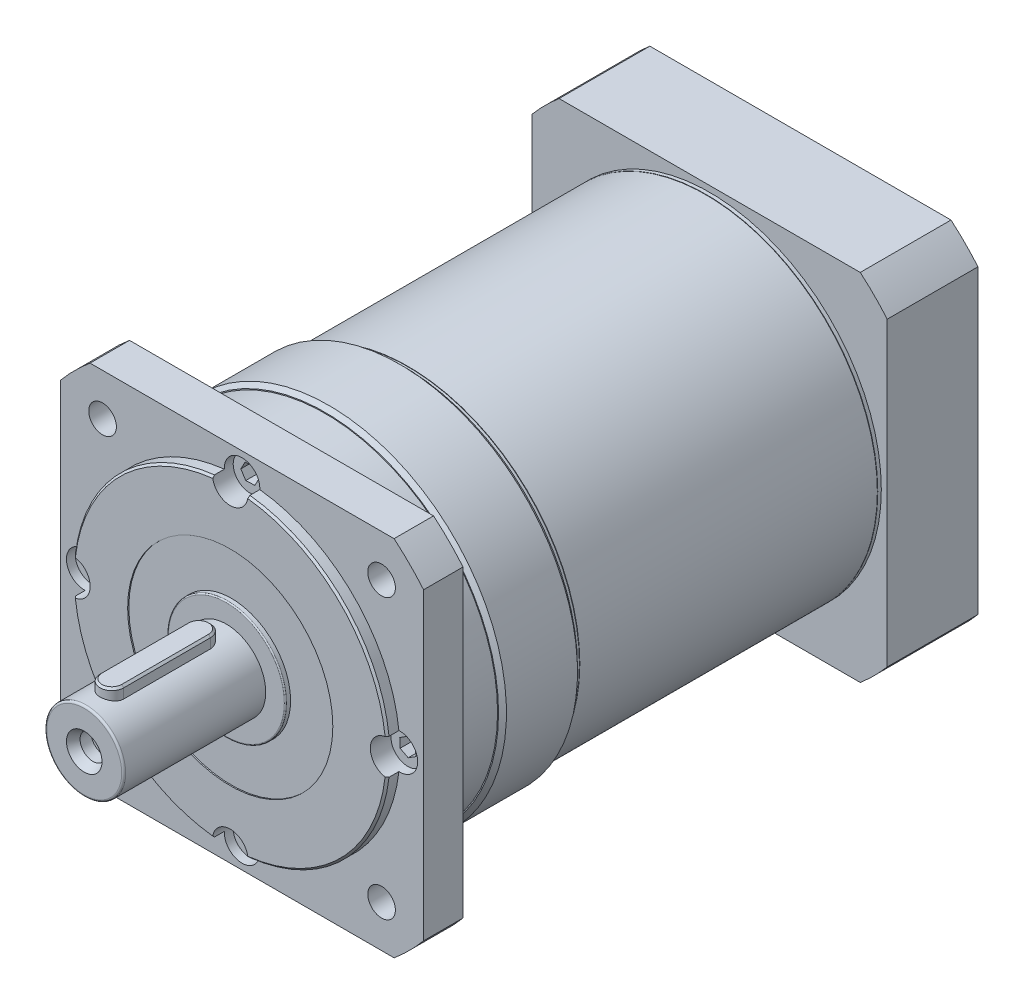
SolidWorks part; units mm, degrees
ref_plane "前视基准面" through (0, 0, 0) normal (0, 0, 1) x (1, 0, 0)
ref_plane "上视基准面" through (0, 0, 0) normal (0, 1, 0) x (1, 0, 0)
ref_plane "右视基准面" through (0, 0, 0) normal (1, 0, 0) x (0, 0, -1)
sketch "草图1" plane through (0, 0, 0) normal (0, 0, 1) x (1, 0, 0)
  circle A0 centre (0, 0) radius 45
extrude "凸台-拉伸1" add sketch "草图1" along normal blind 42
sketch "草图2" plane through (0, 0, 42) normal (0, 0, 1) x (1, 0, 0)
  circle A0 centre (0, 0) radius 40
extrude "凸台-拉伸2" add sketch "草图2" along normal blind 3
sketch "草图3" plane through (0, 0, 0) normal (0, 0, -1) x (-1, 0, 0)
  circle A0 centre (0, 0) radius 43.5
extrude "切除-拉伸1" cut sketch "草图3" against normal blind 1 flip side to cut
sketch "草图25" plane through (0, 0, 42) normal (0, 0, 1) x (1, 0, 0)
  line L1 (-46, 46) -> (46, 46)
  line L2 (-46, 46) -> (-46, -46)
  line L3 (-46, -46) -> (46, -46)
  line L4 (46, 46) -> (46, -46)
  dimension "D1" = 46
  dimension "D2" = 92
  dimension "D3" = 46
  dimension "D4" = 92
extrude "凸台-拉伸13" add sketch "草图25" against normal blind 10
sketch "草图26" plane through (0, 0, 42) normal (0, 0, 1) x (1, 0, 0)
  circle A0 centre (0, 0) radius 60
extrude "切除-拉伸8" cut sketch "草图26" against normal blind 10 flip side to cut
sketch "草图27" plane through (0, 0, 42) normal (0, 0, 1) x (1, 0, 0)
  line L0 (0, 0) -> (-42.4264, 42.4264) construction
  circle A0 centre (0, 0) radius 50 construction
  arc A1 (-38.5227, 46) -> (-46, 38.5227) centre (0, 0) ccw construction
  circle A2 centre (-35.3553, 35.3553) radius 3.5
extrude "切除-拉伸9" cut sketch "草图27" against normal blind 10
pattern_circular "阵列(圆周)6" count 4 over 360 about axis through (0, 0, 0) along (0, 0, 1) of "切除-拉伸9"
sketch "草图28" plane through (0, 0, 32) normal (0, 0, -1) x (-1, 0, 0)
  circle A0 centre (0, 0) radius 43.75
extrude "切除-拉伸10" cut sketch "草图28" along normal blind 11 flip side to cut
chamfer "倒角5" distance 1 angle 45 1 edges at (-45, 0, 21)
chamfer "倒角1" distance 1 angle 45 1 edges at (-45, 0, 1)
ref_plane "基准面1" through (0, 0, -0.1) normal (0, 0, -1) x (-1, 0, 0)
sketch "草图4" plane through (0, 0, -0.1) normal (0, 0, -1) x (-1, 0, 0)
  circle A0 centre (0, 0) radius 43.5
extrude "凸台-拉伸3" add sketch "草图4" along normal blind 75.4 separate body
ref_plane "基准面2" through (0, 0, -75.6) normal (0, 0, -1) x (-1, 0, 0)
sketch "草图5" plane through (0, 0, -75.6) normal (0, 0, -1) x (-1, 0, 0)
  circle A0 centre (0, 0) radius 43.5
extrude "凸台-拉伸4" add sketch "草图5" along normal blind 0.9 separate body
sketch "草图6" plane through (0, 0, -76.5) normal (0, 0, -1) x (-1, 0, 0)
  line L1 (-38.1576, 45) -> (38.1576, 45)
  line L2 (-45, 38.1576) -> (-45, -38.1576)
  line L3 (-38.1576, -45) -> (38.1576, -45)
  line L4 (45, 38.1576) -> (45, -38.1576)
  arc A0 (-38.1576, 45) -> (-45, 38.1576) centre (0, 0) ccw
  arc A1 (-45, -38.1576) -> (-38.1576, -45) centre (0, 0) ccw
  arc A2 (38.1576, -45) -> (45, -38.1576) centre (0, 0) ccw
  arc A3 (45, 38.1576) -> (38.1576, 45) centre (0, 0) ccw
  dimension "D1" = 45
  dimension "D3" = 45
extrude "凸台-拉伸5" add sketch "草图6" along normal blind 23
sketch "草图7" plane through (0, 0, -99.5) normal (0, 0, -1) x (-1, 0, 0)
  circle A0 centre (0, 0) radius 35
extrude "切除-拉伸2" cut sketch "草图7" against normal blind 6
sketch "草图8" plane through (0, 0, -93.5) normal (0, 0, -1) x (-1, 0, 0)
  circle A0 centre (0, 0) radius 32
extrude "切除-拉伸3" cut sketch "草图8" against normal blind 20
sketch "草图9" plane through (0, 0, -99.5) normal (0, 0, -1) x (-1, 0, 0)
  line L0 (0, 0) -> (0, 40) construction
  line L1 (0, 0) -> (-13.6808, 37.5877) construction
  circle A0 centre (0, 0) radius 40 construction
  circle A1 centre (-13.6808, 37.5877) radius 4.5
  dimension "D1" = 20
extrude "切除-拉伸4" cut sketch "草图9" against normal blind 14
pattern_circular "阵列(圆周)1" count 4 over 360 about axis through (0, 0, 0) along (0, 0, 1) of "切除-拉伸4"
sketch "草图10" plane through (0, 0, -99.5) normal (0, 0, -1) x (-1, 0, 0)
  line L0 (0, 0) -> (-31.8198, 31.8198)
  circle A0 centre (0, 0) radius 45
hole_wizard "M5 螺纹孔1" positions "3D草图1" profile "草图11" tap size "M5" standard "GB"
sketch3d "3D草图1"
  point P0 (31.8198, 31.8198, -99.5)
sketch "草图11" plane through (31.8198, 31.8198, -99.5) normal (1, 0, 0) x (0, 1, 0)
  line L0 (0, 0) -> (0, 17.2618)
  line L1 (0, 17.2618) -> (2.1, 16)
  line L2 (2.1, 16) -> (2.1, 0)
  line L5 (2.1, 0) -> (0, 0)
  line L10 (0, 17.2618) -> (-2.1, 16) construction
  line L11 (0, -6.35) -> (0, 107.95) construction
  dimension "螺纹孔钻头直径" = 4.2
  dimension "螺纹孔钻头深度" = 16
  dimension "导头角度" = 118
pattern_circular "阵列(圆周)2" count 4 over 360 about axis through (0, 0, 0) along (0, 0, 1) of "M5 螺纹孔1"
sketch "草图12" plane through (0, 0, -85.5) normal (0, 0, -1) x (-1, 0, 0)
  line L1 (-12.6133, 39.6356) -> (-14.9205, 39.5362)
  line L2 (-14.9205, 39.5362) -> (-15.9881, 37.4883)
  line L3 (-15.9881, 37.4883) -> (-14.7484, 35.5399)
  line L4 (-14.7484, 35.5399) -> (-12.4411, 35.6393)
  line L5 (-12.4411, 35.6393) -> (-11.3735, 37.6871)
  line L6 (-11.3735, 37.6871) -> (-12.6133, 39.6356)
  circle A0 centre (-13.6808, 37.5877) radius 4.25
  circle A1 centre (-13.6808, 37.5877) radius 2 construction
  dimension "D1" = 4
extrude "凸台-拉伸6" add sketch "草图12" along normal blind 5
pattern_circular "阵列(圆周)3" count 4 over 360 about axis through (0, 0, 0) along (0, 0, 1) of "凸台-拉伸6"
sketch "草图13" plane through (0, 0, 42) normal (0, 0, 1) x (1, 0, 0)
  line L0 (0, 0) -> (0, -40) construction
  circle A0 centre (0, 0) radius 40 construction
  circle A1 centre (0, -40) radius 4.5
extrude "切除-拉伸5" cut sketch "草图13" against normal blind 7
pattern_circular "阵列(圆周)4" count 4 over 360 about axis through (0, 0, 0) along (0, 0, 1) of "切除-拉伸5"
sketch "草图14" plane through (0, 0, 35) normal (0, 0, 1) x (1, 0, 0)
  line L1 (1.0702, -37.9535) -> (-1.2372, -38.05)
  line L2 (-1.2372, -38.05) -> (-2.3074, -40.0965)
  line L3 (-2.3074, -40.0965) -> (-1.0702, -42.0465)
  line L4 (-1.0702, -42.0465) -> (1.2372, -41.95)
  line L5 (1.2372, -41.95) -> (2.3074, -39.9035)
  line L6 (2.3074, -39.9035) -> (1.0702, -37.9535)
  circle A0 centre (0, -40) radius 4.25
  circle A1 centre (0, -40) radius 2 construction
  dimension "D1" = 4
extrude "凸台-拉伸7" add sketch "草图14" along normal blind 5
pattern_circular "阵列(圆周)5" count 4 over 360 about axis through (0, 0, 0) along (0, 0, 1) of "凸台-拉伸7"
sketch "草图15" plane through (0, 0, 42) normal (0, 0, 1) x (1, 0, 0)
  line L0 (0, 0) -> (-24.7487, 24.7487)
  circle A0 centre (0, 0) radius 35
ref_plane "基准面3" through (0, 0, -92.5) normal (0, 0, -1) x (-1, 0, 0)
sketch "草图17" plane through (0, 0, -92.5) normal (0, 0, -1) x (-1, 0, 0)
  circle A0 centre (0, 0) radius 26
extrude "凸台-拉伸8" add sketch "草图17" against normal up to surface (19 mm away)
chamfer "倒角2" distance 1.5 angle 45 1 edges at (-26, 0, -92.5)
sketch "草图18" plane through (0, 0, -92.5) normal (0, 0, -1) x (-1, 0, 0)
  line L1 (-30.5825, 0.5) -> (30.8028, 0.5)
  line L2 (-30.5825, 0.5) -> (-30.5825, -0.5)
  line L3 (-30.5825, -0.5) -> (30.8028, -0.5)
  line L4 (30.8028, 0.5) -> (30.8028, -0.5)
  dimension "D1" = 0.5
  dimension "D2" = 1
extrude "切除-拉伸6" cut sketch "草图18" against normal up to surface (19 mm away)
sketch "草图19" plane through (0, 0, -99.5) normal (0, 0, -1) x (-1, 0, 0)
  circle A0 centre (0, 0) radius 9.5
extrude "切除-拉伸7" cut sketch "草图19" against normal blind 42
chamfer "倒角3" distance 0.5 angle 45 1 edges at (40, 0, 45)
sketch "草图20" plane through (0, 0, 45) normal (0, 0, 1) x (1, 0, 0)
  circle A0 centre (0, 0) radius 15
extrude "凸台-拉伸9" add sketch "草图20" along normal blind 1
fillet "圆角2" radius 0.3 1 edges at (15, 0, 46)
sketch "草图22" plane through (0, 0, 46) normal (0, 0, 1) x (1, 0, 0)
  circle A0 centre (0, 0) radius 10
extrude "凸台-拉伸10" add sketch "草图22" along normal blind 36
fillet "圆角3" radius 0.5 1 edges at (10, 0, 82)
sketch "草图23" plane through (0, 0, 0) normal (0, 1, 0) x (1, 0, 0)
  line L0 (-9.5, -82) -> (9.5, -82) construction
  line L1 (-3, -53) -> (-3, -75)
  line L2 (3, -53) -> (3, -75)
  arc A0 (-3, -75) -> (3, -75) centre (0, -75) ccw
  arc A1 (3, -53) -> (-3, -53) centre (0, -53) ccw
  dimension "D1" = 7
  dimension "D2" = 22
extrude "凸台-拉伸11" add sketch "草图23" along normal blind 12.5
chamfer "倒角4" distance 0.5 angle 45 4 edges at (-3, 12.5, 64) (0, 12.5, 78) (0, 12.5, 50) (3, 12.5, 64)
sketch "草图30" plane through (0, 0, 45) normal (0, 0, 1) x (1, 0, 0)
  circle A0 centre (0, 40) radius 4.5
extrude "切除-拉伸11" cut sketch "草图30" against normal up to surface (3 mm away)
pattern_circular "阵列(圆周)8" count 4 over 360 about axis through (0, 0, 45) along (0, 0, -1) of "切除-拉伸11"
sketch "草图31" plane through (0, 0, 45) normal (0, 0, 1) x (1, 0, 0)
  circle A0 centre (0, 0) radius 26
  circle A1 centre (0, 0) radius 15
extrude "切除-拉伸12" cut sketch "草图31" against normal blind 0.3
sketch "草图32" plane through (0, 0, 82) normal (0, 0, 1) x (1, 0, 0)
  circle A0 centre (0, 0) radius 4.5
sketch "草图33" plane through (0, 0, 82) normal (0, 0, 1) x (1, 0, 0)
  circle A0 centre (0, 0) radius 3.25
extrude "切除-拉伸13" cut sketch "草图33" against normal blind 5
ref_plane "基准面4" through (0, 0, 79.8) normal (0, 0, 1) x (1, 0, 0)
sketch "草图34" plane through (0, 0, 79.8) normal (0, 0, 1) x (1, 0, 0)
  circle A0 centre (0, 0) radius 3.25 construction
  circle A1 centre (0, 0) radius 3.25
loft "切除-放样1" cut profiles "草图34", "草图32"
hole_wizard "M6 螺纹孔1" positions "3D草图2" profile "草图35" tap size "M6" standard "GB"
sketch3d "3D草图2"
  line L0 (0, 0, 77) -> (0, 0, 79.8) construction
  point P0 (0, 0, 77)
sketch "草图35" plane through (0, 0, 77) normal (1, 0, 0) x (0, -1, 0)
  line L0 (0, 0) -> (0, 18.0022)
  line L1 (0, 18.0022) -> (2.5, 16.5)
  line L2 (2.5, 16.5) -> (2.5, 0)
  line L5 (2.5, 0) -> (0, 0)
  line L10 (0, 18.0022) -> (-2.5, 16.5) construction
  line L11 (0, -6.35) -> (0, 107.95) construction
  dimension "螺纹孔钻头直径" = 5
  dimension "螺纹孔钻头深度" = 16.5
  dimension "导头角度" = 118
